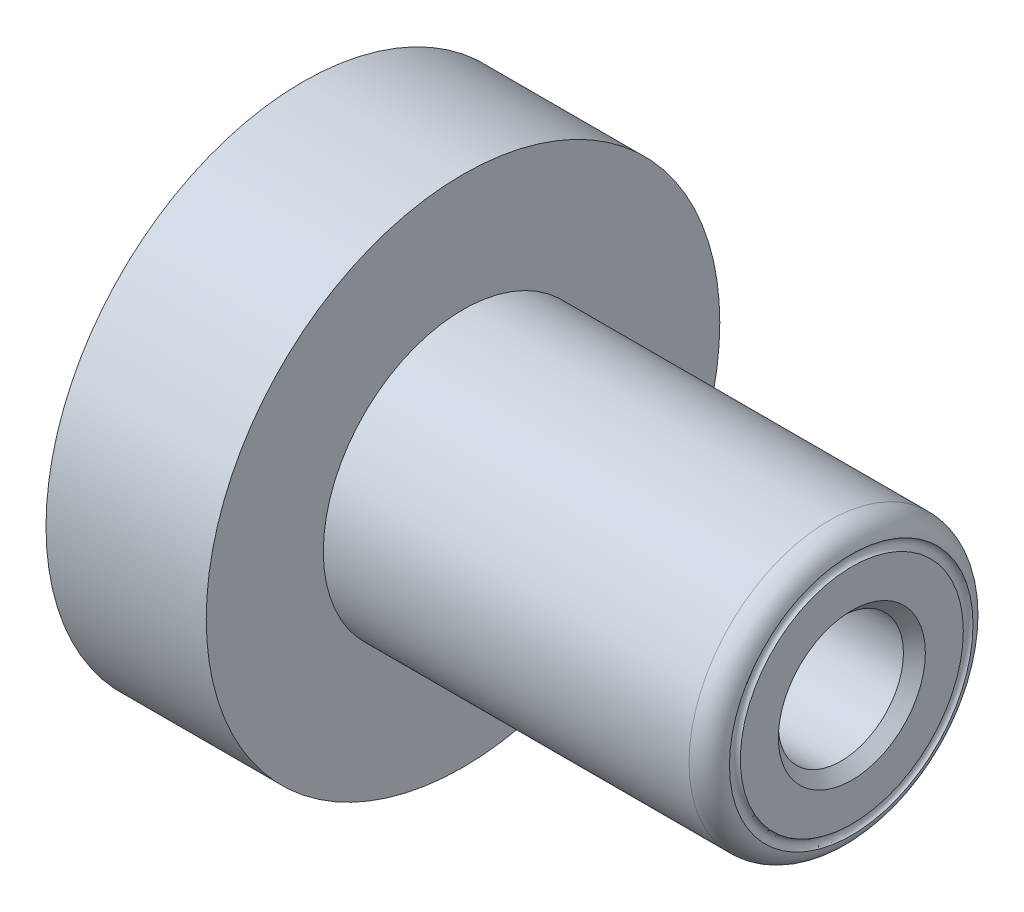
SolidWorks part; units mm, degrees
ref_plane "Front Plane" through (0, 0, 0) normal (0, 0, 1) x (1, 0, 0)
ref_plane "Top Plane" through (0, 0, 0) normal (0, 1, 0) x (1, 0, 0)
ref_plane "Right Plane" through (0, 0, 0) normal (1, 0, 0) x (0, 0, -1)
sketch "Sketch1" plane through (0, 0, 0) normal (0, 0, 1) x (1, 0, 0)
  line L0 (0, 0) -> (102.3864, 0) construction
  line L1 (0, 6.7437) -> (0, 17.4625)
  line L2 (0, 17.4625) -> (10.8966, 17.4625)
  line L3 (10.8966, 17.4625) -> (10.8966, 9.4996)
  line L4 (10.8966, 9.4996) -> (35.768, 9.4996)
  line L5 (37.338, 7.9296) -> (37.338, 0)
  line L6 (37.338, 0) -> (20.447, 0)
  line L7 (0, 6.7437) -> (20.447, 6.7437)
  line L8 (20.447, 6.7437) -> (20.447, 0)
  arc A0 (37.338, 7.9296) -> (35.768, 9.4996) centre (35.768, 7.9296) ccw
  dimension "D5" = 1.57
  dimension "D1" = 10.8966
  dimension "D2" = 34.925
  dimension "D3" = 20.447
  dimension "D4" = 13.4874
  dimension "D6" = 37.338
  dimension "D7" = 18.9992
revolve "Revolve1" add sketch "Sketch1" angle 360 about L0
sketch "Sketch2" plane through (0, 0, 0) normal (-1, 0, 0) x (0, 0, 1)
  line L0 (0, 0) -> (0, 9.7644) construction
  circle A0 centre (-11.1125, 0) radius 1.6129
  circle A1 centre (11.1125, 0) radius 1.6129
  dimension "D2" = 3.2258
  dimension "D1" = 22.225
extrude "Cut-Extrude1" cut sketch "Sketch2" against normal blind 6.35
sketch "Sketch3" plane through (37.338, 0, 0) normal (1, 0, 0) x (0, 0, -1)
  circle A0 centre (0, 0) radius 4.255
  dimension "D1" = 8.51
extrude "Cut-Extrude2" cut sketch "Sketch3" against normal through all
chamfer "Chamfer1" distance 0.745 angle 45 1 edges at (37.338, 0, -4.255)
sketch "Sketch4" plane through (0, 0, 0) normal (0, 0, 1) x (1, 0, 0)
  line L0 (0, 0) -> (40.0607, 0) construction
  line L1 (0, 17.4625) -> (0, -17.4625) construction
  circle A0 centre (37.467, 7.94) radius 0.381
  dimension "D1" = 7.94
  dimension "D2" = 37.467
  dimension "D3" = 0.381
revolve "Cut-Revolve1" cut sketch "Sketch4" angle 360 about L0
